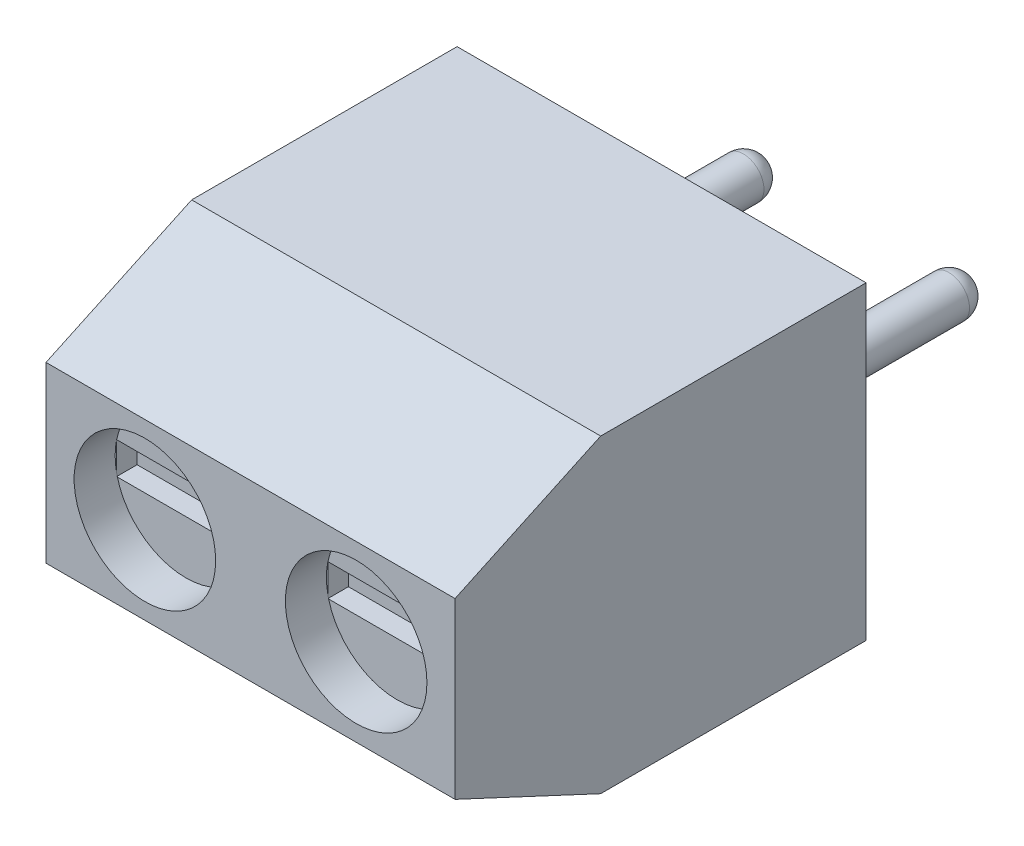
SolidWorks part; units mm, degrees
ref_plane "Face" through (0, 0, 0) normal (0, 0, 1) x (1, 0, 0)
ref_plane "Dessus" through (0, 0, 0) normal (0, 1, 0) x (1, 0, 0)
ref_plane "Droite" through (0, 0, 0) normal (1, 0, 0) x (0, 0, -1)
sketch "Esquisse1" plane through (0, 0, 0) normal (0, 0, 1) x (1, 0, 0)
  line L1 (0, 0) -> (9.97, 0)
  line L2 (0, 0) -> (0, 7.55)
  line L3 (0, 7.55) -> (9.97, 7.55)
  line L4 (9.97, 0) -> (9.97, 7.55)
  dimension "D1" = 9.97
  dimension "D2" = 7.55
extrude "Extrusion1" add sketch "Esquisse1" along normal blind 10.02
chamfer "Chanfrein1" distance 3.55 angle 25 2 edges at (4.985, 7.55, 10.02) (4.985, 0, 10.02)
sketch "Esquisse2" plane through (0, 0, 10.02) normal (0, 0, 1) x (1, 0, 0)
  line L0 (0, 3.775) -> (9.97, 3.775) construction
  line L1 (0, 5.8946) -> (0, 1.6554) construction
  line L2 (9.97, 1.6554) -> (9.97, 5.8946) construction
  line L3 (4.985, 5.8946) -> (4.985, 1.6554) construction
  line L4 (9.97, 5.8946) -> (0, 5.8946) construction
  line L5 (0, 1.6554) -> (9.97, 1.6554) construction
  circle A0 centre (2.4101, 3.775) radius 1.725
  circle A1 centre (7.5599, 3.775) radius 1.725
  dimension "D1" = 3.45
extrude "Enlèv. mat.-Extru.1" cut sketch "Esquisse2" against normal blind 1
sketch "Esquisse3" plane through (0, 0, 0) normal (0, -1, 0) x (1, 0, 0)
  line L0 (4.985, 6.47) -> (4.985, 0) construction
  line L1 (9.97, 6.47) -> (0, 6.47) construction
  line L2 (0, 0) -> (9.97, 0) construction
  line L4 (9.435, 5.8) -> (5.435, 5.8)
  line L5 (9.435, 5.8) -> (9.435, 0.8)
  line L6 (9.435, 0.8) -> (5.435, 0.8)
  line L7 (5.435, 5.8) -> (5.435, 0.8)
  line L8 (4.535, 5.8) -> (0.535, 5.8)
  line L9 (4.535, 5.8) -> (4.535, 0.8)
  line L10 (4.535, 0.8) -> (0.535, 0.8)
  line L11 (0.535, 5.8) -> (0.535, 0.8)
  dimension "D1" = 5
  dimension "D2" = 4
  dimension "D3" = 0.8
  dimension "D4" = 0.9
extrude "Enlèv. mat.-Extru.2" cut sketch "Esquisse3" against normal blind 1.6
sketch "Esquisse4" plane through (0, 1.6, 0) normal (0, -1, 0) x (1, 0, 0)
  line L0 (9.97, 3.235) -> (0, 3.235) construction
  line L1 (9.97, 6.47) -> (9.97, 0) construction
  line L2 (0, 6.47) -> (0, 0) construction
  line L3 (7.435, 5.8) -> (7.435, 0.8) construction
  line L4 (9.435, 5.8) -> (5.435, 5.8) construction
  line L5 (5.435, 0.8) -> (9.435, 0.8) construction
  line L6 (2.535, 5.8) -> (2.535, 0.8) construction
  line L7 (4.535, 5.8) -> (0.535, 5.8) construction
  line L8 (0.535, 0.8) -> (4.535, 0.8) construction
  circle A0 centre (7.435, 3.235) radius 1.675
  circle A1 centre (2.535, 3.235) radius 1.675
  dimension "D1" = 3.35
extrude "Enlèv. mat.-Extru.3" cut sketch "Esquisse4" against normal blind 1.6
sketch "Esquisse5" plane through (0, 0, 0) normal (0, 0, -1) x (-1, 0, 0)
  line L0 (-9.97, 3.775) -> (0, 3.775) construction
  line L1 (-9.97, 0) -> (-9.97, 7.55) construction
  line L2 (0, 7.55) -> (0, 0) construction
  line L3 (-4.985, 7.55) -> (-4.985, 0) construction
  line L4 (-9.97, 7.55) -> (0, 7.55) construction
  line L5 (0, 0) -> (-9.97, 0) construction
  circle A0 centre (-7.49, 3.775) radius 0.5
  circle A1 centre (-2.48, 3.775) radius 0.5
  dimension "D1" = 1
  dimension "D2" = 5.01
extrude "Extrusion2" add sketch "Esquisse5" along normal blind 5
fillet "Congé1" radius 0.5 2 edges at (6.99, 3.775, -5) (1.98, 3.775, -5)
sketch "Esquisse7" plane through (0, 0, 9.02) normal (0, 0, 1) x (1, 0, 0)
  line L1 (0.721, 4.1248) -> (4.0806, 4.1248)
  line L2 (0.721, 4.1248) -> (0.721, 3.3447)
  line L3 (0.721, 3.3447) -> (4.0806, 3.3447)
  line L4 (4.0806, 4.1248) -> (4.0806, 3.3447)
  line L5 (5.8707, 4.1248) -> (9.2304, 4.1248)
  line L6 (5.8707, 4.1248) -> (5.8707, 3.3447)
  line L7 (5.8707, 3.3447) -> (9.2304, 3.3447)
  line L8 (9.2304, 4.1248) -> (9.2304, 3.3447)
  circle A0 centre (2.4101, 3.775) radius 1.725 construction
  circle A1 centre (7.5599, 3.775) radius 1.725 construction
extrude "Enlèv. mat.-Extru.4" cut sketch "Esquisse7" against normal blind 0.5
sketch "Esquisse8" plane through (0, 3.2, 0) normal (0, -1, 0) x (1, 0, 0)
  line L1 (0.9436, 3.7576) -> (4.1396, 3.7576)
  line L2 (0.9436, 3.7576) -> (0.9436, 2.7545)
  line L3 (0.9436, 2.7545) -> (4.1396, 2.7545)
  line L4 (4.1396, 3.7576) -> (4.1396, 2.7545)
  line L5 (5.8436, 3.7576) -> (9.0396, 3.7576)
  line L6 (5.8436, 3.7576) -> (5.8436, 2.7545)
  line L7 (5.8436, 2.7545) -> (9.0396, 2.7545)
  line L8 (9.0396, 3.7576) -> (9.0396, 2.7545)
  circle A0 centre (2.535, 3.235) radius 1.675 construction
  circle A1 centre (7.435, 3.235) radius 1.675 construction
extrude "Enlèv. mat.-Extru.5" cut sketch "Esquisse8" against normal blind 0.5
